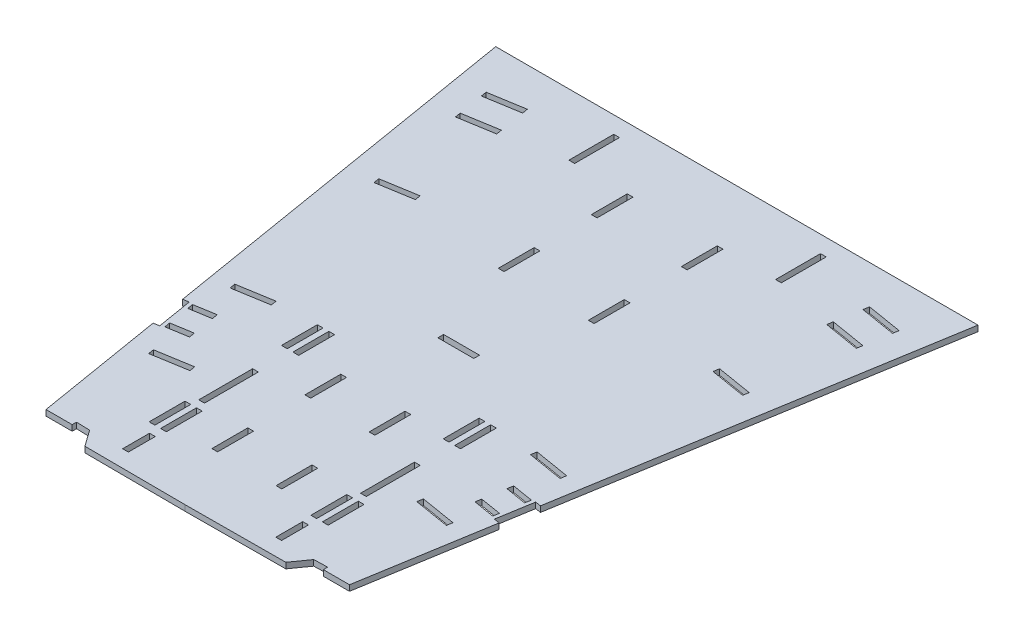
SolidWorks part; units mm, degrees
ref_plane "Front Plane" through (0, 0, 0) normal (0, 0, 1) x (1, 0, 0)
ref_plane "Top Plane" through (0, 0, 0) normal (0, 1, 0) x (1, 0, 0)
ref_plane "Right Plane" through (0, 0, 0) normal (1, 0, 0) x (0, 0, -1)
sketch "Sketch1" plane through (0, 0, 0) normal (0, 1, 0) x (1, 0, 0)
  line L0 (42.6616, 122.8332) -> (-85.3233, 122.8332)
  line L1 (-85.3233, 122.8332) -> (-68.8072, 23.2239)
  line L2 (-61.6001, -20.2426) -> (-54.6476, -20.2426)
  line L3 (-54.6476, -20.2426) -> (-54.6476, -19.0898)
  line L4 (-54.6476, -19.0898) -> (-51.0633, -19.2027)
  line L5 (-51.0633, -19.2027) -> (-47.9998, -23.5212)
  line L6 (-21.3308, 122.8332) -> (-21.3308, -23.6578) construction
  line L7 (-47.9998, -23.5212) -> (-21.3308, -23.6578)
  line L8 (5.3381, -23.5212) -> (-21.3308, -23.6578)
  line L9 (8.4016, -19.2027) -> (5.3381, -23.5212)
  line L10 (11.9859, -19.0898) -> (8.4016, -19.2027)
  line L11 (11.9859, -20.2426) -> (11.9859, -19.0898)
  line L12 (18.9384, -20.2426) -> (11.9859, -20.2426)
  line L13 (42.6616, 122.8332) -> (26.1455, 23.2239)
  line L14 (-32.5158, 96.9231) -> (-34.0398, 96.9231)
  line L15 (-10.1458, 81.7574) -> (-8.6218, 81.7574)
  line L16 (-10.1458, 81.7574) -> (-10.1458, 72.2324)
  line L17 (-10.1458, 72.2324) -> (-8.6218, 72.2324)
  line L18 (-8.6218, 81.7574) -> (-8.6218, 72.2324)
  line L19 (-8.6218, 96.9231) -> (-8.6218, 106.4481)
  line L20 (-10.1458, 106.4481) -> (-8.6218, 106.4481)
  line L21 (-10.1458, 96.9231) -> (-10.1458, 106.4481)
  line L22 (-10.1458, 96.9231) -> (-8.6218, 96.9231)
  line L23 (-32.5158, 96.9231) -> (-32.5158, 106.4481)
  line L24 (-32.5158, 106.4481) -> (-34.0398, 106.4481)
  line L25 (-34.0398, 96.9231) -> (-34.0398, 106.4481)
  line L26 (-34.0398, 81.7574) -> (-34.0398, 72.2324)
  line L27 (-32.5158, 72.2324) -> (-34.0398, 72.2324)
  line L28 (-32.5158, 81.7574) -> (-32.5158, 72.2324)
  line L29 (-32.5158, 81.7574) -> (-34.0398, 81.7574)
  line L30 (-29.0864, 17.4804) -> (-30.6104, 17.4804)
  line L31 (-29.0864, 17.4804) -> (-29.0864, 27.0054)
  line L32 (-29.0864, 27.0054) -> (-30.6104, 27.0054)
  line L33 (-30.6104, 17.4804) -> (-30.6104, 27.0054)
  line L34 (-30.6104, 2.3146) -> (-30.6104, -7.2104)
  line L35 (-29.0864, -7.2104) -> (-30.6104, -7.2104)
  line L36 (-29.0864, 2.3146) -> (-29.0864, -7.2104)
  line L37 (-29.0864, 2.3146) -> (-30.6104, 2.3146)
  line L38 (-13.5752, 2.3146) -> (-12.0512, 2.3146)
  line L39 (-13.5752, 2.3146) -> (-13.5752, -7.2104)
  line L40 (-13.5752, -7.2104) -> (-12.0512, -7.2104)
  line L41 (-12.0512, 2.3146) -> (-12.0512, -7.2104)
  line L42 (-12.0512, 17.4804) -> (-12.0512, 27.0054)
  line L43 (-13.5752, 27.0054) -> (-12.0512, 27.0054)
  line L44 (-13.5752, 17.4804) -> (-13.5752, 27.0054)
  line L45 (-13.5752, 17.4804) -> (-12.0512, 17.4804)
  line L46 (-45.0848, 35.2555) -> (-43.5608, 35.2555)
  line L47 (-43.5608, 16.5634) -> (-43.5608, 2.2523)
  line L48 (-2.1488, 35.2555) -> (-0.6248, 35.2555)
  line L49 (-2.1488, 35.2555) -> (-2.1488, 25.7305)
  line L50 (-2.1488, 25.7305) -> (-0.6248, 25.7305)
  line L51 (-0.6248, 35.2555) -> (-0.6248, 25.7305)
  line L52 (-42.0368, 2.2523) -> (-43.5608, 2.2523)
  line L53 (0.8992, 35.2555) -> (0.8992, 25.7305)
  line L54 (2.4232, 25.7305) -> (0.8992, 25.7305)
  line L55 (2.4232, 35.2555) -> (2.4232, 25.7305)
  line L56 (2.4232, 35.2555) -> (0.8992, 35.2555)
  line L57 (-42.0368, 16.5634) -> (-42.0368, 2.2523)
  line L58 (-0.6248, 16.5634) -> (0.8992, 16.5634)
  line L59 (-0.6248, 16.5634) -> (-0.6248, 2.2523)
  line L60 (-0.6248, 2.2523) -> (0.8992, 2.2523)
  line L61 (0.8992, 16.5634) -> (0.8992, 2.2523)
  line L62 (-42.0368, 16.5634) -> (-43.5608, 16.5634)
  line L63 (-45.0848, 35.2555) -> (-45.0848, 25.7305)
  line L64 (-45.0848, 25.7305) -> (-43.5608, 25.7305)
  line L65 (-43.5608, 35.2555) -> (-43.5608, 25.7305)
  line L66 (-42.0368, 35.2555) -> (-42.0368, 25.7305)
  line L67 (-40.5128, 25.7305) -> (-42.0368, 25.7305)
  line L68 (-40.5128, 35.2555) -> (-40.5128, 25.7305)
  line L69 (-40.5128, 35.2555) -> (-42.0368, 35.2555)
  line L70 (2.4232, -9.3924) -> (0.8992, -9.3924)
  line L71 (24.5875, 13.8272) -> (18.9384, -20.2426)
  line L72 (26.1455, 23.2239) -> (24.6421, 23.4732)
  line L73 (24.5875, 13.8272) -> (23.084, 14.0765)
  line L74 (-67.3037, 23.4732) -> (-65.7456, 14.0765)
  line L75 (24.6421, 23.4732) -> (23.084, 14.0765)
  line L76 (-67.2491, 13.8272) -> (-65.7456, 14.0765)
  line L77 (-68.8072, 23.2239) -> (-67.3037, 23.4732)
  line L78 (-67.2491, 13.8272) -> (-61.6001, -20.2426)
  line L79 (-65.3695, 104.3935) -> (-65.1202, 102.8901)
  line L80 (-74.7662, 102.8355) -> (-74.5169, 101.332)
  line L81 (-61.0782, 78.5124) -> (-60.8289, 77.0089)
  line L82 (27.8132, 76.9544) -> (18.4165, 78.5124)
  line L83 (32.1045, 102.8355) -> (22.7078, 104.3935)
  line L84 (27.5639, 75.4509) -> (18.1672, 77.0089)
  line L85 (31.8553, 101.332) -> (22.4585, 102.8901)
  line L86 (27.8132, 76.9544) -> (27.5639, 75.4509)
  line L87 (18.4165, 78.5124) -> (18.1672, 77.0089)
  line L88 (32.1045, 102.8355) -> (31.8553, 101.332)
  line L89 (22.7078, 104.3935) -> (22.4585, 102.8901)
  line L90 (-70.4749, 76.9544) -> (-70.2256, 75.4509)
  line L91 (-74.5169, 101.332) -> (-65.1202, 102.8901)
  line L92 (-70.2256, 75.4509) -> (-60.8289, 77.0089)
  line L93 (-74.7662, 102.8355) -> (-65.3695, 104.3935)
  line L94 (-70.4749, 76.9544) -> (-61.0782, 78.5124)
  line L95 (18.4165, 7.7423) -> (9.0198, 9.3003)
  line L96 (22.7078, 33.6234) -> (13.3111, 35.1814)
  line L97 (22.7078, 33.6234) -> (22.4585, 32.1199)
  line L98 (18.1672, 6.2388) -> (8.7705, 7.7969)
  line L99 (22.4585, 32.1199) -> (13.0618, 33.678)
  line L100 (18.4165, 7.7423) -> (18.1672, 6.2388)
  line L101 (9.0198, 9.3003) -> (8.7705, 7.7969)
  line L102 (13.3111, 35.1814) -> (13.0618, 33.678)
  line L103 (-65.3695, 33.6234) -> (-65.1202, 32.1199)
  line L104 (-55.9728, 35.1814) -> (-55.7235, 33.678)
  line L105 (-51.6814, 9.3003) -> (-51.4322, 7.7969)
  line L106 (-61.0782, 7.7423) -> (-60.8289, 6.2388)
  line L107 (-65.1202, 32.1199) -> (-55.7235, 33.678)
  line L108 (-60.8289, 6.2388) -> (-51.4322, 7.7969)
  line L109 (-65.3695, 33.6234) -> (-55.9728, 35.1814)
  line L110 (-61.0782, 7.7423) -> (-51.6814, 9.3003)
  line L111 (-49.5238, 118.3544) -> (-49.5238, 106.4481)
  line L112 (5.3381, 118.3544) -> (6.8621, 118.3544)
  line L113 (5.3381, 118.3544) -> (5.3381, 106.4481)
  line L114 (5.3381, 106.4481) -> (6.8621, 106.4481)
  line L115 (6.8621, 118.3544) -> (6.8621, 106.4481)
  line L116 (-47.9998, 106.4481) -> (-49.5238, 106.4481)
  line L117 (-47.9998, 118.3544) -> (-47.9998, 106.4481)
  line L118 (-47.9998, 118.3544) -> (-49.5238, 118.3544)
  line L119 (-40.8938, -19.0898) -> (-40.8938, -11.946)
  line L120 (-0.2438, -19.0898) -> (-1.7678, -19.0898)
  line L121 (-0.2438, -19.0898) -> (-0.2438, -11.946)
  line L122 (-0.2438, -11.946) -> (-1.7678, -11.946)
  line L123 (-1.7678, -19.0898) -> (-1.7678, -11.946)
  line L124 (-42.4178, -11.946) -> (-40.8938, -11.946)
  line L125 (-42.4178, -19.0898) -> (-42.4178, -11.946)
  line L126 (-42.4178, -19.0898) -> (-40.8938, -19.0898)
  line L127 (27.4062, 103.6145) -> (27.9656, 106.9881) construction
  line L128 (27.9656, 106.9881) -> (17.7851, 108.6761) construction
  line L129 (23.8266, 111.1408) -> (24.0759, 112.6443)
  line L130 (33.2233, 109.5828) -> (33.4726, 111.0862)
  line L131 (33.4726, 111.0862) -> (24.0759, 112.6443)
  line L132 (33.2233, 109.5828) -> (23.8266, 111.1408)
  line L133 (-75.8849, 109.5828) -> (-66.4882, 111.1408)
  line L134 (-76.1342, 111.0862) -> (-66.7375, 112.6443)
  line L135 (-75.8849, 109.5828) -> (-76.1342, 111.0862)
  line L136 (-66.4882, 111.1408) -> (-66.7375, 112.6443)
  line L137 (-2.1488, 0.1326) -> (-2.1488, -9.3924)
  line L138 (-40.5128, -9.3924) -> (-42.0368, -9.3924)
  line L139 (-45.0848, 0.1326) -> (-45.0848, -9.3924)
  line L140 (-0.6248, 0.1326) -> (-0.6248, -9.3924)
  line L141 (-43.5608, 0.1326) -> (-43.5608, -9.3924)
  line L142 (2.4232, 0.1326) -> (2.4232, -9.3924)
  line L143 (-40.5128, 0.1326) -> (-40.5128, -9.3924)
  line L144 (-2.1488, 0.1326) -> (-0.6248, 0.1326)
  line L145 (-45.0848, 0.1326) -> (-43.5608, 0.1326)
  line L146 (0.8992, 0.1326) -> (0.8992, -9.3924)
  line L147 (-42.0368, 0.1326) -> (-42.0368, -9.3924)
  line L148 (2.4232, 0.1326) -> (0.8992, 0.1326)
  line L149 (-2.1488, -9.3924) -> (-0.6248, -9.3924)
  line L150 (-40.5128, 0.1326) -> (-42.0368, 0.1326)
  line L151 (-45.0848, -9.3924) -> (-43.5608, -9.3924)
extrude "Boss-Extrude1" add sketch "Sketch1" along normal blind 1.524
sketch "Sketch2" plane through (0, 0, 0) normal (0, -1, 0) x (1, 0, 0)
  line L0 (22.4157, -16.069) -> (16.8079, -16.9988)
  line L2 (22.1609, -14.5364) -> (16.5526, -15.4663)
  line L4 (22.4157, -16.069) -> (22.1609, -14.5364)
  line L5 (16.8079, -16.9988) -> (16.5526, -15.4663)
  line L6 (23.863, -18.7749) -> (9.4167, -21.1702) construction
  line L7 (23.084, -14.0765) -> (24.6421, -23.4732) construction
  line L8 (17.7587, -22.7329) -> (18.0116, -24.2658)
  line L9 (23.3664, -21.8031) -> (23.6199, -23.3359)
  line L10 (23.6199, -23.3359) -> (18.0116, -24.2658)
  line L11 (23.3664, -21.8031) -> (17.7587, -22.7329)
  line L12 (-21.3308, 23.6578) -> (-21.3308, 81.1569) construction
  line L13 (-66.028, -21.8031) -> (-60.4203, -22.7329)
  line L14 (-66.2816, -23.3359) -> (-60.6733, -24.2658)
  line L15 (-66.028, -21.8031) -> (-66.2816, -23.3359)
  line L16 (-60.4203, -22.7329) -> (-60.6733, -24.2658)
  line L17 (-59.4696, -16.9988) -> (-59.2142, -15.4663)
  line L18 (-65.0773, -16.069) -> (-64.8225, -14.5364)
  line L19 (-64.8225, -14.5364) -> (-59.2142, -15.4663)
  line L20 (-65.0773, -16.069) -> (-59.4696, -16.9988)
extrude "Cut-Extrude1" cut sketch "Sketch2" against normal blind 1.524
sketch "Sketch3" plane through (0, 0, 0) normal (0, -1, 0) x (1, 0, 0)
  line L1 (-21.3308, -49.7695) -> (-21.3308, -48.2455) construction
  line L2 (-10.1458, -49.7695) -> (-32.5158, -49.7695) construction
  line L3 (-16.5683, -49.7695) -> (-16.5683, -48.2455)
  line L4 (-26.0933, -49.7695) -> (-26.0933, -48.2455)
  line L5 (-16.5683, -49.7695) -> (-26.0933, -49.7695)
  line L6 (-16.5683, -48.2455) -> (-26.0933, -48.2455)
  dimension "D1" = 4.7625
  dimension "D2" = 4.7625
extrude "Cut-Extrude2" cut sketch "Sketch3" against normal blind 1.524
